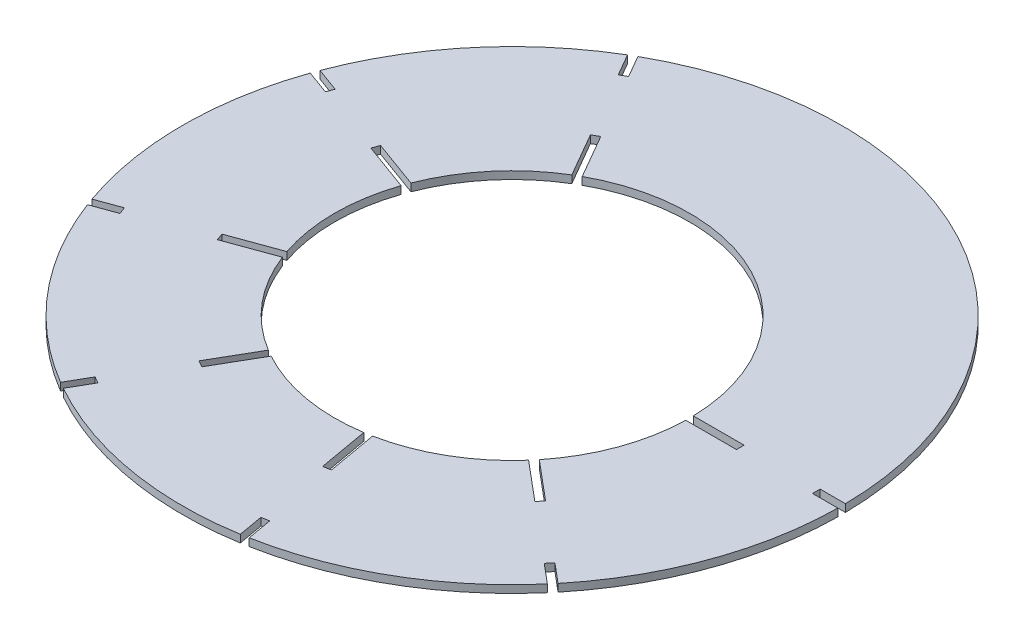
SolidWorks part; units mm, degrees
ref_plane "Front Plane" through (0, 0, 0) normal (0, 0, 1) x (1, 0, 0)
ref_plane "Top Plane" through (0, 0, 0) normal (0, 1, 0) x (1, 0, 0)
ref_plane "Right Plane" through (0, 0, 0) normal (1, 0, 0) x (0, 0, -1)
sketch "Sketch1" plane through (0, 0, 0) normal (0, 1, 0) x (1, 0, 0)
  circle A0 centre (0, 0) radius 650
  circle A1 centre (0, 0) radius 350
extrude "Boss-Extrude1" add sketch "Sketch1" along normal blind 15 contours A0
sketch "Sketch2" plane through (0, 15, 0) normal (0, 1, 0) x (1, 0, 0)
  line L0 (0, 0) -> (650, 0) construction
  line L1 (600, 7.5) -> (700, 7.5)
  line L2 (345, 7.5) -> (450, 7.5)
  line L3 (345, 7.5) -> (345, -7.5)
  line L4 (345, -7.5) -> (450, -7.5)
  line L5 (450, 7.5) -> (450, -7.5)
  line L6 (600, 7.5) -> (600, -7.5)
  line L7 (600, -7.5) -> (700, -7.5)
  line L8 (111.575, -589.5823) -> (128.9398, -688.0631)
  line L9 (67.2947, -338.4563) -> (85.5277, -441.8611)
  line L10 (67.2947, -338.4563) -> (52.5226, -341.061)
  line L11 (52.5226, -341.061) -> (70.7556, -444.4659)
  line L12 (85.5277, -441.8611) -> (70.7556, -444.4659)
  line L13 (111.575, -589.5823) -> (96.8028, -592.187)
  line L14 (96.8028, -592.187) -> (114.1677, -690.6678)
  line L15 (464.4476, -379.9272) -> (541.052, -444.206)
  line L16 (269.1062, -216.0164) -> (349.5409, -283.5091)
  line L17 (269.1062, -216.0164) -> (259.4644, -227.5071)
  line L18 (259.4644, -227.5071) -> (339.8991, -294.9998)
  line L19 (349.5409, -283.5091) -> (339.8991, -294.9998)
  line L20 (464.4476, -379.9272) -> (454.8058, -391.4179)
  line L21 (454.8058, -391.4179) -> (531.4102, -455.6967)
  line L22 (0, 0) -> (112.8713, -640.125) construction
  line L23 (-293.5048, -523.3652) -> (-343.5048, -609.9678)
  line L24 (-166.0048, -302.5288) -> (-218.5048, -393.4614)
  line L25 (-166.0048, -302.5288) -> (-178.9952, -295.0288)
  line L26 (-178.9952, -295.0288) -> (-231.4952, -385.9614)
  line L27 (-218.5048, -393.4614) -> (-231.4952, -385.9614)
  line L28 (-293.5048, -523.3652) -> (-306.4952, -515.8652)
  line L29 (0, 0) -> (497.9289, -417.8119) construction
  line L30 (-306.4952, -515.8652) -> (-356.4952, -602.4678)
  line L31 (0, 0) -> (-325, -562.9165) construction
  line L32 (-561.2504, -212.2598) -> (-655.2197, -246.4618)
  line L33 (-321.6288, -125.0446) -> (-420.2965, -160.9568)
  line L34 (-321.6288, -125.0446) -> (-326.7591, -110.9493)
  line L35 (-326.7591, -110.9493) -> (-425.4268, -146.8614)
  line L36 (-420.2965, -160.9568) -> (-425.4268, -146.8614)
  line L37 (-561.2504, -212.2598) -> (-566.3807, -198.1644)
  line L38 (-566.3807, -198.1644) -> (-660.35, -232.3664)
  line L39 (0, 0) -> (-610.8002, -222.3131) construction
  line L40 (-566.3807, 198.1644) -> (-660.35, 232.3664)
  line L41 (-326.7591, 110.9493) -> (-425.4268, 146.8614)
  line L42 (-326.7591, 110.9493) -> (-321.6288, 125.0446)
  line L43 (-321.6288, 125.0446) -> (-420.2965, 160.9568)
  line L44 (-425.4268, 146.8614) -> (-420.2965, 160.9568)
  line L45 (-566.3807, 198.1644) -> (-561.2504, 212.2598)
  line L46 (-561.2504, 212.2598) -> (-655.2197, 246.4618)
  line L47 (0, 0) -> (-610.8002, 222.3131) construction
  line L48 (700, 7.5) -> (700, -7.5)
  line L49 (541.052, -444.206) -> (531.4102, -455.6967)
  line L50 (128.9398, -688.0631) -> (114.1677, -690.6678)
  line L51 (-343.5048, -609.9678) -> (-356.4952, -602.4678)
  line L52 (-655.2197, -246.4618) -> (-660.35, -232.3664)
  line L53 (-660.35, 232.3664) -> (-655.2197, 246.4618)
  line L54 (-306.4952, 515.8652) -> (-356.4952, 602.4678)
  line L55 (-178.9952, 295.0288) -> (-231.4952, 385.9614)
  line L56 (-178.9952, 295.0288) -> (-166.0048, 302.5288)
  line L57 (-166.0048, 302.5288) -> (-218.5048, 393.4614)
  line L58 (-231.4952, 385.9614) -> (-218.5048, 393.4614)
  line L59 (-306.4952, 515.8652) -> (-293.5048, 523.3652)
  line L60 (-293.5048, 523.3652) -> (-343.5048, 609.9678)
  line L61 (0, 0) -> (-325, 562.9165) construction
  line L62 (-356.4952, 602.4678) -> (-343.5048, 609.9678)
  circle A0 centre (0, 0) radius 650 construction
  point P23 (0, 0)
extrude "Cut-Extrude3" cut sketch "Sketch2" against normal blind 15 contours L35 L36 L33 L34 | L24 L27 L26 L25 | L9 L12 L11 L10 | L16 L19 L18 L17 | L2 L5 L4 L3 | L41 L44 L43 L42 | L1 L48 L7 L6 | L21 L49 L15 L20 | L14 L50 L8 L13 | L30 L51 L23 L28 | L38 L52 L32 L37 | L46 L53 L40 L45 | L57 L58 L55 L56 | L60 L62 L54 L59
equation "\"Inner Circle\"= 350mm"
equation "\"D2@Sketch1\"= \"Inner Circle\""
equation "\"D4@Sketch2\" = \"Inner Circle\" - \"CutExtrude Clearing\""
equation "\"D1@Sketch2\"= 100 + \"CutExtrude Clearing\""
equation "\"CutExtrude Clearing\"= 5mm"
